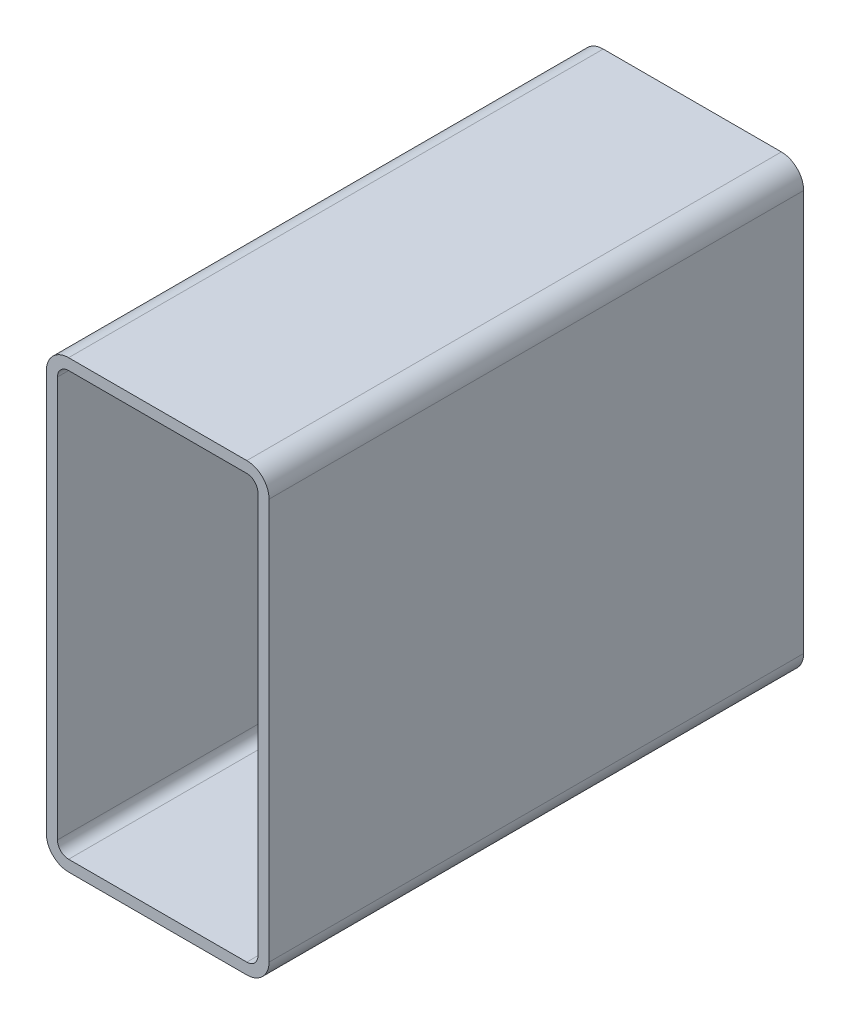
SolidWorks part; units mm, degrees
ref_plane "Front Plane" through (0, 0, 0) normal (0, 0, 1) x (1, 0, 0)
ref_plane "Top Plane" through (0, 0, 0) normal (0, 1, 0) x (1, 0, 0)
ref_plane "Right Plane" through (0, 0, 0) normal (1, 0, 0) x (0, 0, -1)
sketch "Sketch1" plane through (0, 0, 0) normal (0, 0, 1) x (1, 0, 0)
sketch_block_instance "HSS10x5x0.250-1"
sketch_block "HSS10x5x0.250"
extrude "Boss-Extrude1" add sketch "Sketch1" along normal blind 304.8
